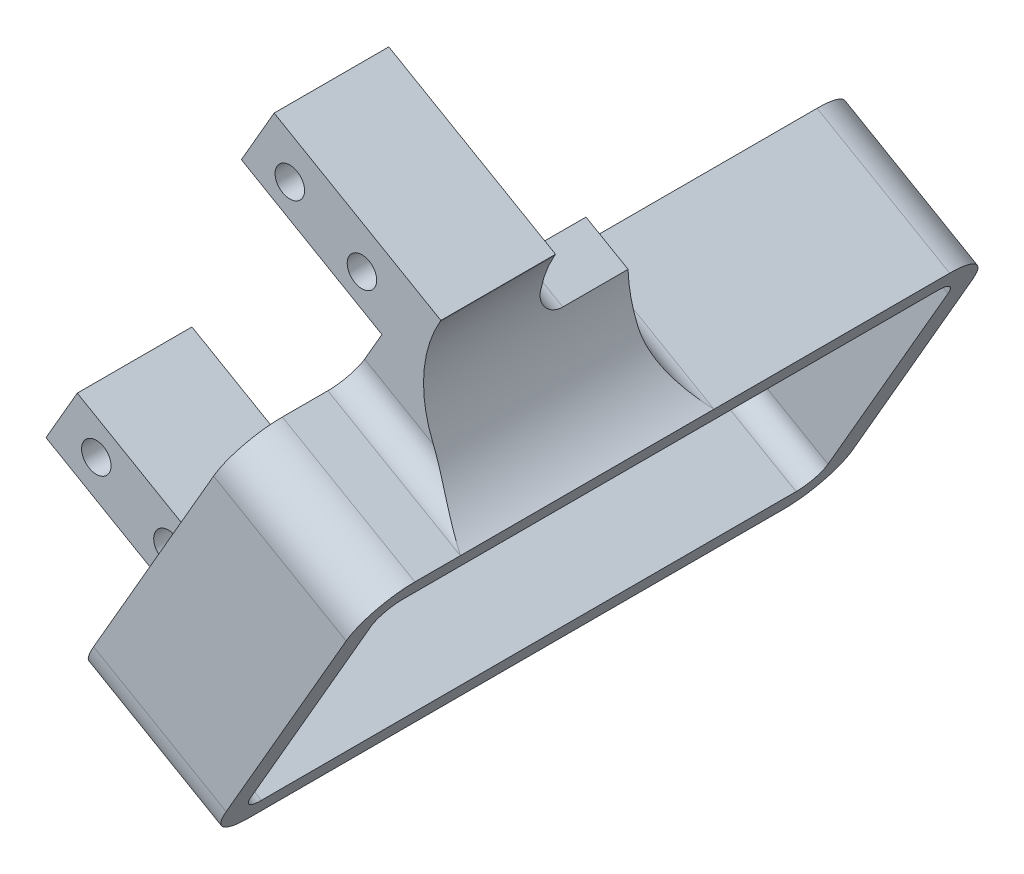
SolidWorks part; units mm, degrees
ref_plane "Plan de face" through (0, 0, 0) normal (0, 0, 1) x (1, 0, 0)
ref_plane "Plan de dessus" through (0, 0, 0) normal (0, 1, 0) x (1, 0, 0)
ref_plane "Plan de droite" through (0, 0, 0) normal (1, 0, 0) x (0, 0, -1)
sketch "Esquisse3" plane through (0, 0, 0) normal (0, 0, 1) x (1, 0, 0)
  line L0 (14.8911, -4.1979) -> (34.8311, 30.3391) construction
  line L1 (-5.5136, 0.1002) -> (-2.2736, 5.7121) construction
  line L2 (-2.3236, 5.6255) -> (14.8411, -4.2845)
  line L3 (-2.3236, 5.6255) -> (14.8411, -4.2845)
  line L4 (-6.1436, -0.991) -> (-2.3236, 5.6255)
  line L5 (31.7533, 17.4283) -> (17.1033, -7.9462) construction
  line L6 (14.8411, -4.2845) -> (34.8811, 30.4258)
  line L8 (14.2167, -12.746) -> (-6.1436, -0.991)
  line L9 (14.2167, -12.746) -> (42.0767, 35.509)
  line L10 (17.6664, 40.2491) -> (20.9064, 45.861) construction
  line L11 (34.8811, 30.4258) -> (17.7164, 40.3358)
  line L12 (34.8811, 30.4258) -> (17.7164, 40.3358)
  line L13 (17.7164, 40.3358) -> (21.7164, 47.264)
  line L17 (21.7164, 47.264) -> (42.0767, 35.509)
  dimension "D3" = 8
  dimension "D4" = 7.64
  dimension "D5" = 0.1
  dimension "D1" = 0.1
  dimension "D2" = 0.1
extrude "Extrusion2" add sketch "Esquisse3" along normal up to surface and the other way up to surface
sketch "Esquisse2" plane through (0, 0, 0) normal (0, 0, 1) x (1, 0, 0)
  line L0 (17.7164, 40.3358) -> (34.8811, 30.4258) construction
  line L1 (32.4375, 39.0823) -> (29.6325, 37.4628)
  line L2 (29.6325, 37.4628) -> (29.6325, 34.2239)
  line L3 (29.6325, 34.2239) -> (32.4375, 32.6044)
  line L4 (32.4375, 32.6044) -> (35.2425, 34.2239)
  line L5 (35.2425, 34.2239) -> (35.2425, 37.4628)
  line L6 (35.2425, 37.4628) -> (32.4375, 39.0823)
  line L7 (23.63, 37.6894) -> (26.435, 39.3089)
  line L8 (26.435, 39.3089) -> (26.435, 42.5478)
  line L9 (26.435, 42.5478) -> (23.63, 44.1673)
  line L10 (23.63, 44.1673) -> (20.825, 42.5478)
  line L11 (20.825, 42.5478) -> (20.825, 39.3089)
  line L12 (20.825, 39.3089) -> (23.63, 37.6894)
  line L13 (8.8075, -8.3239) -> (11.6125, -6.7045)
  line L14 (11.6125, -6.7045) -> (11.6125, -3.4655)
  line L15 (11.6125, -3.4655) -> (8.8075, -1.8461)
  line L16 (8.8075, -1.8461) -> (6.0025, -3.4655)
  line L17 (6.0025, -3.4655) -> (6.0025, -6.7045)
  line L18 (6.0025, -6.7045) -> (8.8075, -8.3239)
  line L19 (0, -3.2389) -> (2.805, -1.6195)
  line L20 (2.805, -1.6195) -> (2.805, 1.6195)
  line L21 (2.805, 1.6195) -> (0, 3.2389)
  line L22 (0, 3.2389) -> (-2.805, 1.6195)
  line L23 (-2.805, 1.6195) -> (-2.805, -1.6195)
  line L24 (-2.805, -1.6195) -> (0, -3.2389)
  circle A0 centre (32.4375, 35.8434) radius 2.805 construction
  circle A3 centre (23.63, 40.9284) radius 2.805 construction
  circle A4 centre (8.8075, -5.085) radius 2.805 construction
  circle A5 centre (0, 0) radius 2.805 construction
  dimension "D1" = 5.61
extrude "Enlèv. mat.-Extru.1" cut sketch "Esquisse2" against normal through all
sketch "Esquisse4" plane through (12.9861, -7.4975, 0) normal (0.866, -0.5, 0) x (0, 0, -1)
  line L0 (3, 43.79) -> (3, 3.71) construction
  line L1 (3, 43.69) -> (3, 3.81)
  line L2 (-11, 43.69) -> (13.97, 43.69) construction
  line L3 (3, 43.69) -> (13.97, 43.69)
  line L4 (13.97, 3.81) -> (13.97, 43.69) construction
  line L5 (13.97, 3.81) -> (13.97, 43.69)
  line L6 (-11, 3.81) -> (13.97, 3.81) construction
  line L7 (3, 3.81) -> (13.97, 3.81)
extrude "Extrusion3" add sketch "Esquisse4" along normal up to surface (3.69 mm away)
sketch "Esquisse6" plane through (16.1817, -9.3425, 0) normal (0.866, -0.5, 0) x (0, 0, -1)
  line L5 (45.75, 36.57) -> (-19.55, 36.57)
  line L6 (-25.15, 30.97) -> (-25.15, 1.67)
  line L7 (-19.55, -3.93) -> (45.75, -3.93)
  line L8 (51.35, 1.67) -> (51.35, 30.97)
  line L9 (-19.55, -0.93) -> (45.75, -0.93)
  line L10 (-22.15, 30.97) -> (-22.15, 1.67)
  line L11 (45.75, 33.57) -> (-19.55, 33.57)
  line L12 (48.35, 1.67) -> (48.35, 30.97)
  line L13 (-19.55, -0.93) -> (45.75, -0.93)
  line L14 (-22.15, 30.97) -> (-22.15, 1.67)
  line L15 (45.75, 33.57) -> (-19.55, 33.57)
  line L16 (48.35, 1.67) -> (48.35, 30.97)
  arc A4 (-19.55, 36.57) -> (-25.15, 30.97) centre (-19.55, 30.97) ccw
  arc A5 (-25.15, 1.67) -> (-19.55, -3.93) centre (-19.55, 1.67) ccw
  arc A6 (45.75, -3.93) -> (51.35, 1.67) centre (45.75, 1.67) ccw
  arc A7 (51.35, 30.97) -> (45.75, 36.57) centre (45.75, 30.97) ccw
  arc A8 (45.75, -0.93) -> (48.35, 1.67) centre (45.75, 1.67) ccw
  arc A9 (-22.15, 1.67) -> (-19.55, -0.93) centre (-19.55, 1.67) ccw
  arc A10 (-19.55, 33.57) -> (-22.15, 30.97) centre (-19.55, 30.97) ccw
  arc A11 (48.35, 30.97) -> (45.75, 33.57) centre (45.75, 30.97) ccw
  arc A12 (45.75, -0.93) -> (48.35, 1.67) centre (45.75, 1.67) ccw
  arc A13 (-22.15, 1.67) -> (-19.55, -0.93) centre (-19.55, 1.67) ccw
  arc A14 (-19.55, 33.57) -> (-22.15, 30.97) centre (-19.55, 30.97) ccw
  arc A15 (48.35, 30.97) -> (45.75, 33.57) centre (45.75, 30.97) ccw
  dimension "D1" = 0.1
  dimension "D2" = 3
extrude "Extrusion4" add sketch "Esquisse6" along normal blind 15
sketch "Esquisse8" plane through (16.1817, -9.3425, 0) normal (-0.866, 0.5, 0) x (0, 0, 1)
  line L1 (-13.97, 36.57) -> (11, 36.57) construction
  line L2 (-13.97, 36.57) -> (11, 36.57)
  line L3 (11, 36.57) -> (19.55, 36.57) construction
  line L4 (11, 36.57) -> (19.55, 36.57)
  line L5 (25.15, 30.97) -> (25.15, 1.67) construction
  line L6 (25.15, 30.97) -> (25.15, 1.67)
  line L7 (19.55, -3.93) -> (11, -3.93) construction
  line L8 (-3, -3.93) -> (-3, -0.93)
  line L9 (-3, -0.93) -> (-45.75, -0.93)
  line L10 (-48.35, 1.67) -> (-48.35, 30.97)
  line L11 (-45.75, 33.57) -> (-13.97, 33.57)
  line L12 (-13.97, 33.57) -> (-13.97, 36.57)
  line L13 (-13.97, 36.57) -> (-45.75, 36.57)
  line L14 (-51.35, 30.97) -> (-51.35, 1.67)
  line L15 (-45.75, -3.93) -> (-3, -3.93)
  line L16 (19.55, -3.93) -> (11, -3.93)
  line L18 (-3, -3.93) -> (11, -3.93)
  line L21 (-13.97, 36.57) -> (-45.75, 36.57)
  line L22 (-51.35, 30.97) -> (-51.35, 1.67)
  line L23 (-45.75, -3.93) -> (-3, -3.93)
  arc A1 (25.15, 30.97) -> (19.55, 36.57) centre (19.55, 30.97) ccw construction
  arc A2 (25.15, 30.97) -> (19.55, 36.57) centre (19.55, 30.97) ccw
  arc A3 (19.55, -3.93) -> (25.15, 1.67) centre (19.55, 1.67) ccw construction
  arc A4 (-48.35, 1.67) -> (-45.75, -0.93) centre (-45.75, 1.67) ccw
  arc A5 (-45.75, 33.57) -> (-48.35, 30.97) centre (-45.75, 30.97) ccw
  arc A6 (-45.75, 36.57) -> (-51.35, 30.97) centre (-45.75, 30.97) ccw
  arc A7 (-51.35, 1.67) -> (-45.75, -3.93) centre (-45.75, 1.67) ccw
  arc A9 (19.55, -3.93) -> (25.15, 1.67) centre (19.55, 1.67) ccw
  arc A10 (-45.75, 36.57) -> (-51.35, 30.97) centre (-45.75, 30.97) ccw
  arc A11 (-51.35, 1.67) -> (-45.75, -3.93) centre (-45.75, 1.67) ccw
  dimension "D1" = 0
extrude "Extrusion5" add sketch "Esquisse8" along normal up to surface (3.69 mm away)
fillet "Congé1" radius 3 4 edges at (12.9311, -7.5928, -3) (32.8689, 23.2505, 11) (32.8689, 23.2505, -13.97) (36.4289, 29.4166, -3)
fillet "Congé2" radius 15 1 edges at (34.4667, 22.328, -1.485)
hole_wizard "Dégagement M31" positions "Esquisse3D1" profile "Esquisse9" hole size "M3" standard "ISO"
sketch3d "Esquisse3D1"
  point P0 (0, 0, 0)
  point P4 (0, 0, 0)
sketch "Esquisse9" plane through (0, 0, 0) normal (1, 0, 0) x (0, 1, 0)
  line L0 (0, 0) -> (0, 25.15)
  line L1 (0, 25.15) -> (1.8, 25.15)
  line L2 (1.8, 25.15) -> (1.8, 0)
  line L5 (1.8, 0) -> (0, 0)
  line L11 (0, -6.35) -> (0, 107.95) construction
  dimension "Diamètre du perçage jusqu'au prochain" = 3.6
  dimension "Profondeur du perçage jusqu'au prochain" = 25.15
pattern_linear "Répétition linéaire1" count 2 spacing 10.17 along (0.866, -0.5, 0) count 2 spacing 47.26 along (0.5, 0.866, 0) of "Dégagement M31"
